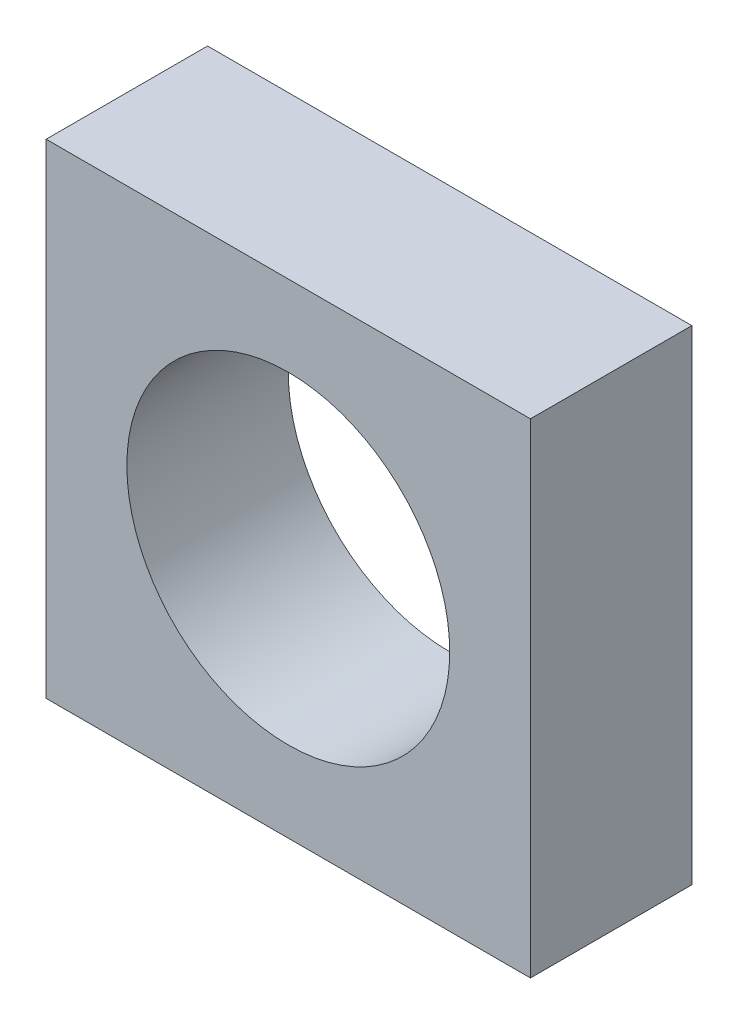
SolidWorks part; units mm, degrees
ref_plane "Face" through (0, 0, 0) normal (0, 0, 1) x (1, 0, 0)
ref_plane "Dessus" through (0, 0, 0) normal (0, 1, 0) x (1, 0, 0)
ref_plane "Droite" through (0, 0, 0) normal (1, 0, 0) x (0, 0, -1)
mirrored part "141C_Rendre symétrique"
other "<141C>-<Extrusion1>"
